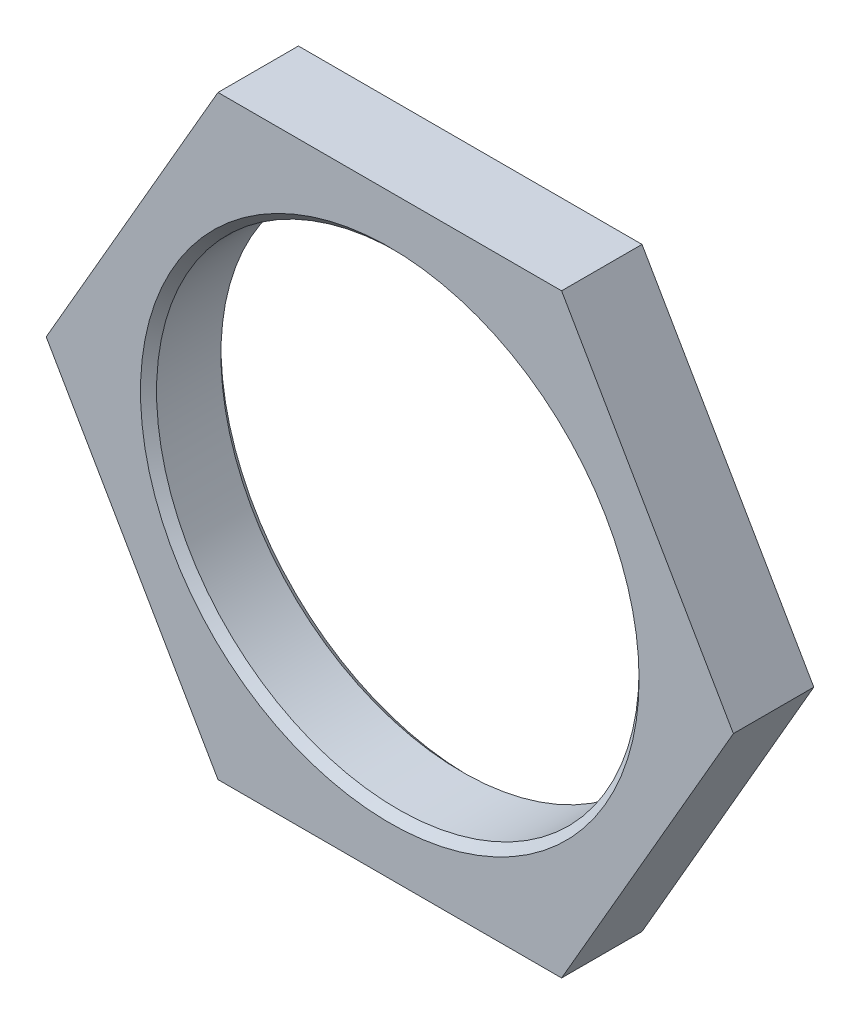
SolidWorks part; units mm, degrees
ref_plane "Plan1" through (0, 0, 0) normal (0, 0, 1) x (1, 0, 0)
ref_plane "Plan2" through (0, 0, 0) normal (0, 1, 0) x (1, 0, 0)
ref_plane "Plan3" through (0, 0, 0) normal (1, 0, 0) x (0, 0, -1)
sketch "Esquisse1" plane through (0, 0, 0) normal (0, 0, 1) x (1, 0, 0)
  line L0 (-20, 0) -> (4.2724, 0) construction
  line L1 (0, 8.564) -> (0, -21.436) construction
  line L2 (-2.1362, 3.7) -> (2.1362, 3.7)
  line L3 (-2.1362, -3.7) -> (2.1362, -3.7)
  line L4 (4.2724, 0) -> (2.1362, -3.7)
  line L5 (4.2724, 0) -> (2.1362, 3.7)
  line L6 (-4.2724, 0) -> (-2.1362, 3.7)
  line L7 (-4.2724, 0) -> (-2.1362, -3.7)
  dimension "D1" = 3.7
  dimension "D2" = 60
  dimension "D3" = 3.7
extrude "Base-Extrusion" add sketch "Esquisse1" along normal blind 1
sketch "Esquisse2" plane through (0, 0, 1) normal (0, 0, 1) x (1, 0, 0)
  circle A0 centre (0, 0) radius 3
  dimension "D1" = 6
extrude "Enlèv. mat.-Extru.1" cut sketch "Esquisse2" against normal through all
chamfer "Chanfrein1" distance 0.1 angle 45 2 edges at (3, 0, 0) (3, 0, 1)
ref_plane "Plan9" through (0, 0, 1.15) normal (0, 0, 1) x (1, 0, 0)
